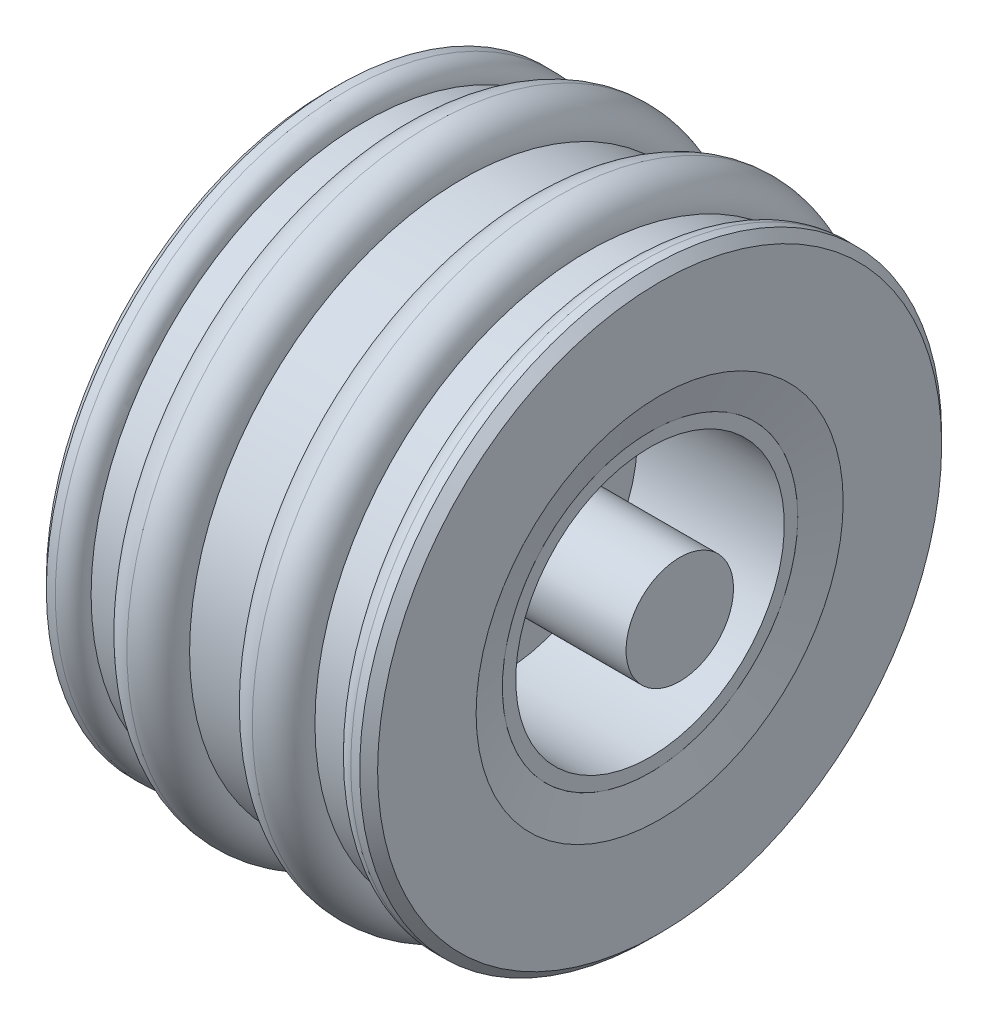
SolidWorks part; units mm, degrees
ref_plane "Front Plane" through (0, 0, 0) normal (0, 0, 1) x (1, 0, 0)
ref_plane "Top Plane" through (0, 0, 0) normal (0, 1, 0) x (1, 0, 0)
ref_plane "Right Plane" through (0, 0, 0) normal (1, 0, 0) x (0, 0, -1)
sketch "Sketch1" plane through (0, 0, 0) normal (0, 0, 1) x (1, 0, 0)
  line L0 (0, 0) -> (0, 165) construction
  line L1 (185, 165) -> (-185, 165)
  line L2 (-185, 165) -> (-185, 325)
  line L3 (-185, 325) -> (-145, 325)
  line L4 (-145, 325) -> (-145, 305)
  line L5 (-145, 305) -> (-105, 305)
  line L6 (-105, 305) -> (-105, 340)
  line L7 (-105, 340) -> (-35, 340)
  line L8 (-35, 340) -> (-35, 305)
  line L9 (-35, 305) -> (35, 305)
  line L10 (35, 305) -> (35, 340)
  line L11 (35, 340) -> (105, 340)
  line L12 (105, 340) -> (105, 305)
  line L13 (105, 305) -> (145, 305)
  line L14 (145, 305) -> (145, 325)
  line L15 (145, 325) -> (185, 325)
  line L16 (185, 325) -> (185, 165)
  line L17 (0, 0) -> (-166.6243, 0) construction
  line L19 (-165, 185) -> (165, 185)
  line L20 (-165, 185) -> (-165, 275)
  line L21 (-165, 275) -> (165, 275)
  line L22 (165, 185) -> (165, 275)
  line L23 (-165, 185) -> (165, 275) construction
  line L24 (-165, 275) -> (165, 185) construction
  point P6 (0, 165)
  point P12 (0, 230)
  dimension "D1" = 370
  dimension "D2" = 40
  dimension "D3" = 40
  dimension "D4" = 70
  dimension "D5" = 70
  dimension "D6" = 40
  dimension "D7" = 40
  dimension "D8" = 20
  dimension "D9" = 325
  dimension "D10" = 160
  dimension "D11" = 35
  dimension "D12" = 20
  dimension "D13" = 20
  dimension "D14" = 30
  dimension "D15" = 20
revolve "Revolve1" add sketch "Sketch1" angle 360 about L17
chamfer "Chamfer1" distance 40 angle 15 2 edges at (-185, 0, -165) (185, 0, -165)
chamfer "Chamfer2" distance 10 angle 45 2 edges at (-185, 0, -325) (185, 0, -325)
fillet "Fillet1" radius 35 4 edges at (-105, 0, -340) (-35, 0, -340) (105, 0, -340) (35, 0, -340)
fillet "Fillet2" radius 20 2 edges at (-145, 0, -325) (145, 0, -325)
sketch "Sketch4" plane through (0, 0, 0) normal (0, 0, 1) x (1, 0, 0)
  line L1 (-174.282, 150) -> (-10, 150)
  line L2 (-174.282, 150) -> (-174.282, 165)
  line L3 (-174.282, 165) -> (174.282, 165)
  line L4 (174.282, 150) -> (174.282, 165)
  line L5 (-174.282, 150) -> (174.282, 165) construction
  line L6 (-174.282, 165) -> (174.282, 150) construction
  line L10 (10, 150) -> (174.282, 150)
  line L11 (-10, 0) -> (10, 0)
  line L12 (-10, 0) -> (-10, 150)
  line L14 (10, 0) -> (10, 150)
  line L15 (-10, 0) -> (10, 150) construction
  line L16 (-10, 150) -> (10, 0) construction
  point P0 (0, 157.5)
  point P5 (0, 0)
  point P11 (0, 75)
  dimension "D1" = 15
  dimension "D2" = 20
revolve "Revolve2" add sketch "Sketch4" angle 360 about L11
sketch "Sketch5" plane through (0, 0, 0) normal (1, 0, 0) x (0, 0, -1)
  circle A0 centre (0, 0) radius 60
  dimension "D1" = 120
extrude "Boss-Extrude1" add sketch "Sketch5" along normal mid plane 415
